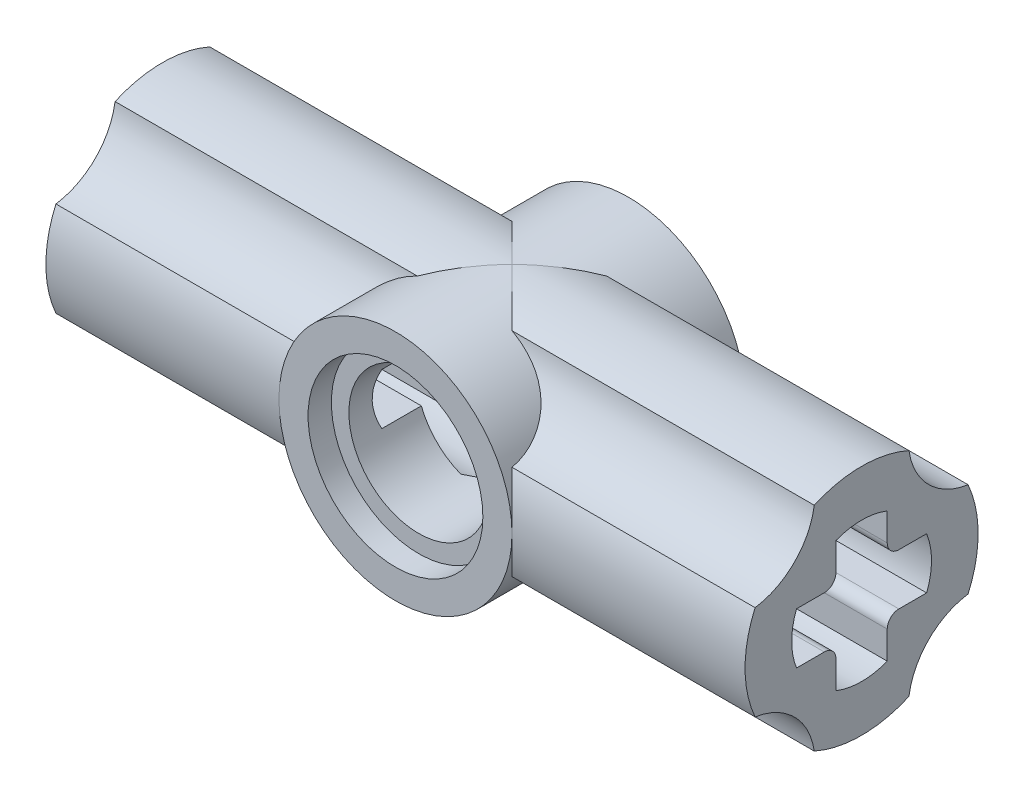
SolidWorks part; units mm, degrees
ref_plane "정면" through (0, 0, 0) normal (0, 0, 1) x (1, 0, 0)
ref_plane "윗면" through (0, 0, 0) normal (0, 1, 0) x (1, 0, 0)
ref_plane "우측면" through (0, 0, 0) normal (1, 0, 0) x (0, 0, -1)
sketch "스케치1" plane through (0, 0, 0) normal (0, 1, 0) x (1, 0, 0)
  line L0 (-8, 4) -> (-12, 4)
  line L1 (-12, 4) -> (-12, -4)
  line L2 (-12, -4) -> (-8, -4)
  line L3 (-8, -4) -> (-8, 4)
  line L4 (-12, 4) -> (-12, -4) construction
revolve "회전1" add sketch "스케치1" angle 360 about L4
sketch "스케치2" plane through (0, 0, 0) normal (1, 0, 0) x (0, 0, -1)
  arc A0 (-1.6249, -3.6551) -> (1.6249, -3.6551) centre (0, 0) ccw
  arc A1 (1.6249, -3.6551) -> (3.6551, -1.6249) centre (4, -4) cw
  arc A2 (3.6551, -1.6249) -> (3.6551, 1.6249) centre (0, 0) ccw
  arc A3 (3.6551, 1.6249) -> (1.6249, 3.6551) centre (4, 4) cw
  arc A4 (1.6249, 3.6551) -> (-1.6249, 3.6551) centre (0, 0) ccw
  arc A5 (-1.6249, 3.6551) -> (-3.6551, 1.6249) centre (-4, 4) cw
  arc A6 (-3.6551, 1.6249) -> (-3.6551, -1.6249) centre (0, 0) ccw
  arc A7 (-3.6551, -1.6249) -> (-1.6249, -3.6551) centre (-4, -4) cw
extrude "보스-돌출1" add sketch "스케치2" against normal up to next
imported_body "곡면-불러온 피처1"
sketch "스케치3" plane through (0, 0, 0) normal (1, 0, 0) x (0, 0, -1)
  line L0 (-0.88, 2.2328) -> (-0.88, 0.88)
  line L1 (-0.88, 0.88) -> (-2.2328, 0.88)
  line L2 (-2.2328, -0.88) -> (-0.88, -0.88)
  line L3 (-0.88, -0.88) -> (-0.88, -2.2328)
  line L4 (0.88, -2.2328) -> (0.88, -0.88)
  line L5 (0.88, -0.88) -> (2.2328, -0.88)
  line L6 (2.2328, 0.88) -> (0.88, 0.88)
  line L7 (0.88, 0.88) -> (0.88, 2.2328)
  arc A0 (-2.2328, 0.88) -> (-2.2328, -0.88) centre (0, 0) ccw
  arc A1 (-0.88, -2.2328) -> (0.88, -2.2328) centre (0, 0) ccw
  arc A2 (2.2328, -0.88) -> (2.2328, 0.88) centre (0, 0) ccw
  arc A3 (0.88, 2.2328) -> (-0.88, 2.2328) centre (0, 0) ccw
extrude "컷-돌출1" cut sketch "스케치3" against normal up to surface
sketch "스케치4" plane through (0, 0, 0) normal (0, 1, 0) x (1, 0, 0)
  line L0 (-9, 4) -> (-12, 4)
  line L1 (-12, 4) -> (-12, -4)
  line L2 (-12, -4) -> (-9, -4)
  line L3 (-9, -4) -> (-9, -3.2)
  line L4 (-9, -3.2) -> (-9.6, -3.2)
  line L5 (-9.6, -3.2) -> (-9.6, 3.2)
  line L6 (-9.6, 3.2) -> (-9, 3.2)
  line L7 (-9, 3.2) -> (-9, 4)
  line L8 (-12, 4) -> (-12, -4) construction
revolve "컷-회전1" cut sketch "스케치4" angle 360 about L8
fillet "필렛1" radius 0.4 4 edges at (-4.049, 0.88, 0.88) (-4.049, 0.88, -0.88) (-4.049, -0.88, -0.88) (-4.049, -0.88, 0.88)
pattern_circular "원형 패턴1" count 2 every 180 about axis through (-12, 0, 0) along (0, 0, 1) of "보스-돌출1", "컷-돌출1"
